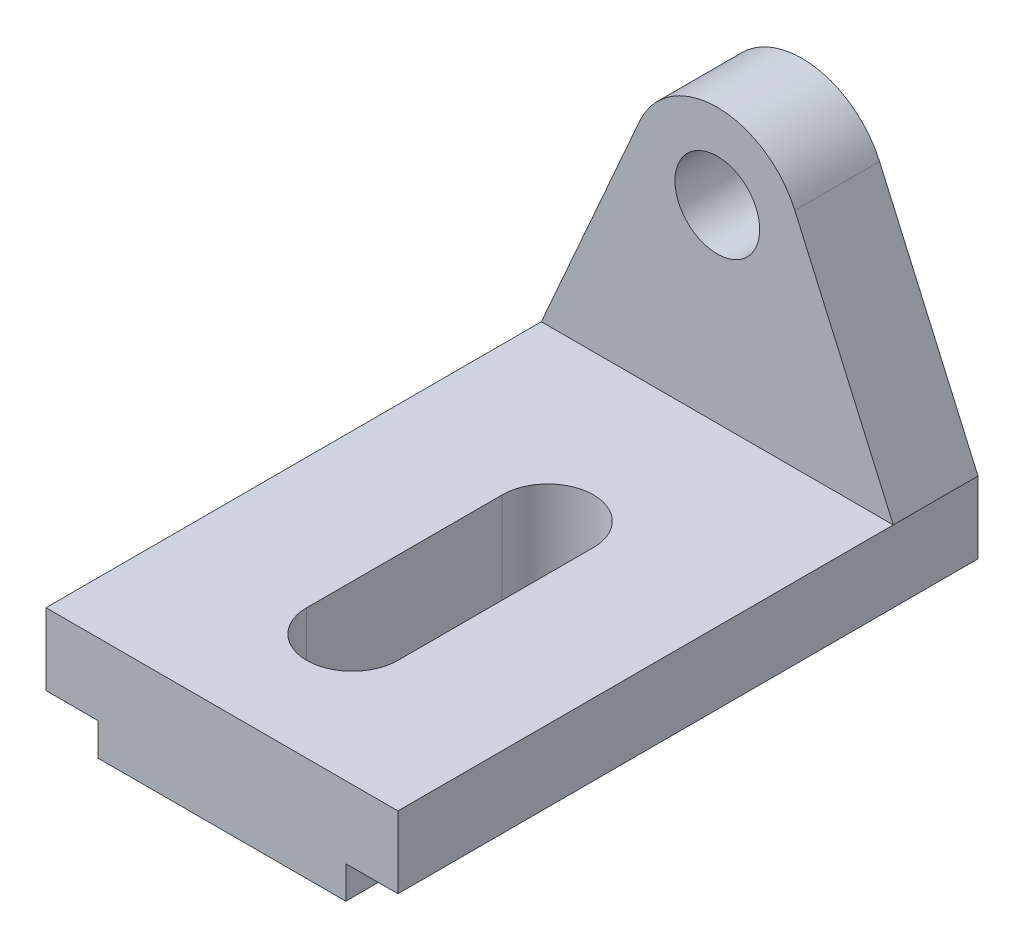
SolidWorks part; units mm, degrees
ref_plane "Plano frontal" through (0, 0, 0) normal (0, 0, 1) x (1, 0, 0)
ref_plane "Plano superior" through (0, 0, 0) normal (0, 1, 0) x (1, 0, 0)
ref_plane "Plano direito" through (0, 0, 0) normal (1, 0, 0) x (0, 0, -1)
sketch "Esboço1" plane through (0, 0, 0) normal (0, 0, 1) x (1, 0, 0)
  line L0 (0, 0) -> (54, 0)
  line L1 (0, 0) -> (0, -16)
  line L2 (0, -16) -> (54, -16)
  line L3 (54, 0) -> (54, -16)
  dimension "D1" = 16
  dimension "D2" = 54
extrude "Ressalto-extrusão2" add sketch "Esboço1" along normal blind 89
sketch "Esboço2" plane through (0, 0, 89) normal (0, 0, 1) x (1, 0, 0)
  line L0 (46, -11.0112) -> (54, -11.0112)
  line L1 (54, -16) -> (54, 0) construction
  line L2 (8, -11.0112) -> (0, -11.0112)
  line L3 (0, 0) -> (0, -16) construction
  line L4 (0, -16) -> (54, -16) construction
  line L8 (8, -16) -> (46, -16)
  line L9 (8, -16) -> (8, -11.0112)
  line L10 (8, -11.0112) -> (46, -11.0112)
  line L11 (46, -16) -> (46, -11.0112)
extrude "Corte-extrusão2" cut sketch "Esboço2" against normal blind 89 contours L9 L2 M10 M9 | L11 L0 M10 M11
sketch "Esboço5" plane through (0, 0, 0) normal (0, 0, -1) x (-1, 0, 0)
  line L0 (-54, 0) -> (-27, 0)
  line L1 (-54, -11.0112) -> (-54, 0) construction
  line L2 (-54, 0) -> (0, 0) construction
  line L3 (-27, 0) -> (-27, 29)
  line L4 (-38.8943, 34.2464) -> (-54, 0)
  line L5 (0, 0) -> (-15.1057, 34.2464)
  arc A0 (-15.1057, 34.2464) -> (-38.8943, 34.2464) centre (-27, 29) ccw
  circle A1 centre (-27, 29) radius 6.5
  dimension "D2" = 26
  dimension "D3" = 13
  dimension "D1" = 29
extrude "Ressalto-extrusão3" add sketch "Esboço5" against normal blind 13
sketch "Esboço6" plane through (0, 0, 0) normal (0, 1, 0) x (1, 0, 0)
  line L0 (0, -89) -> (27, -89)
  line L1 (54, -89) -> (0, -89) construction
  line L4 (27, -39) -> (27, -69) construction
  line L5 (34, -39) -> (34, -69)
  line L6 (20, -39) -> (20, -69)
  arc A0 (34, -39) -> (20, -39) centre (27, -39) ccw
  arc A1 (20, -69) -> (34, -69) centre (27, -69) ccw
  point P5 (27, -54)
  dimension "D2" = 30
  dimension "D3" = 14
extrude "Corte-extrusão3" cut sketch "Esboço6" against normal blind 27
